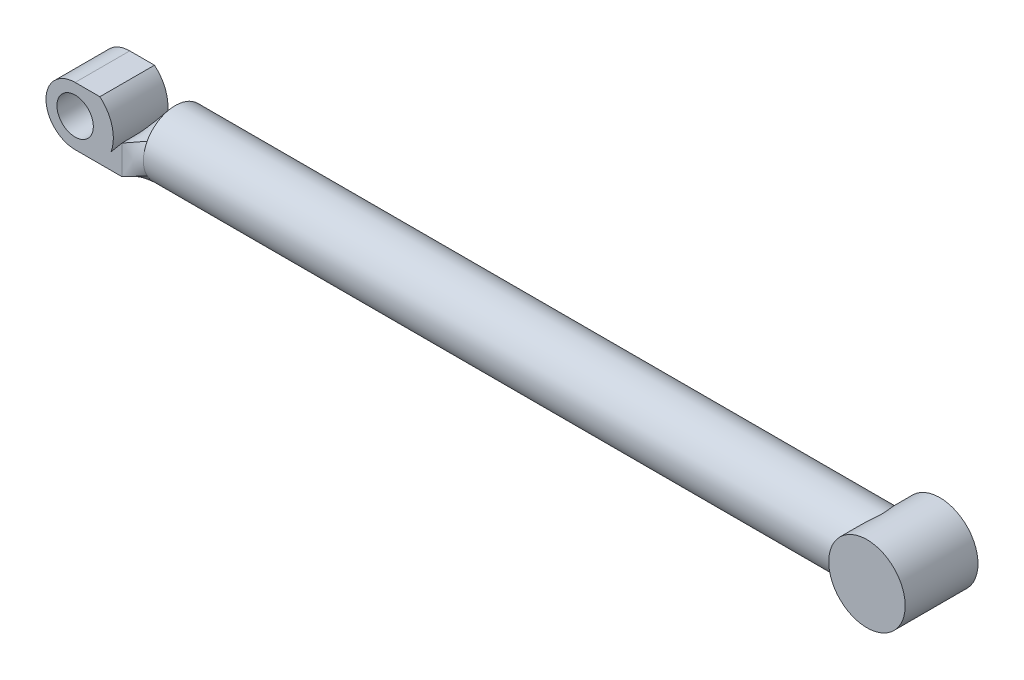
SolidWorks part; units mm, degrees
ref_plane "Front Plane" through (0, 0, 0) normal (0, 0, 1) x (1, 0, 0)
ref_plane "Top Plane" through (0, 0, 0) normal (0, 1, 0) x (1, 0, 0)
ref_plane "Right Plane" through (0, 0, 0) normal (1, 0, 0) x (0, 0, -1)
sketch "Sketch1" plane through (0, 0, 0) normal (0, 0, 1) x (1, 0, 0)
  line L0 (0, 160) -> (136.0147, 160)
  line L1 (0, -160) -> (136.0147, -160)
  circle A0 centre (0, 0) radius 100
  arc A1 (0, 160) -> (0, -160) centre (0, 0) ccw
  arc A2 (136.0147, 160) -> (136.0147, -160) centre (0, 0) cw
  dimension "D1" = 320
  dimension "D2" = 200
  dimension "D3" = 210
extrude "Boss-Extrude1" add sketch "Sketch1" along normal mid plane 300
ref_plane "Plane1" through (400, 0, 0) normal (1, 0, 0) x (0, 0, -1)
sketch "Sketch3" plane through (400, 0, 0) normal (1, 0, 0) x (0, 0, -1)
  line L4 (0, 553.9592) -> (0, -553.9592) construction
  circle A1 centre (0, 0) radius 175
  dimension "D1" = 0
  dimension "D2" = 350
extrude "Boss-Extrude2" add sketch "Sketch3" along normal blind 4000 separate body
sketch "Sketch7" plane through (0, 0, 0) normal (0, 0, 1) x (1, 0, 0)
  line L17 (257.3355, -160) -> (136.0147, -160)
  line L18 (257.3355, -71.8242) -> (257.3355, -160)
  line L19 (0, 0) -> (134.9854, -160.8693) construction
  line L20 (220, 0) -> (-220, 0) construction
  line L21 (0, 0) -> (197.3355, -71.8242) construction
  line L23 (197.3355, -71.8242) -> (257.3355, 0)
  line L24 (257.3355, 0) -> (257.3355, -71.8242)
  arc A4 (136.0147, -160) -> (136.0147, 160) centre (0, 0) ccw construction
  arc A5 (136.0147, -160) -> (197.3355, -71.8242) centre (0, 0) ccw
  dimension "D1" = 50
  dimension "D2" = 20
  dimension "D3" = 60
extrude "Boss-Extrude3" add sketch "Sketch7" along normal mid plane 300
loft "Loft4" add
sketch "Sketch8" plane through (0, 0, 0) normal (0, 0, 1) x (1, 0, 0)
  line L0 (220, 0) -> (-220, 0) construction
  line L1 (0, -220) -> (0, 220) construction
  circle A0 centre (4400, 0) radius 210
extrude "Boss-Extrude4" add sketch "Sketch8" along normal mid plane 400
sketch "Sketch9" plane through (0, 0, -200) normal (0, 0, -1) x (-1, 0, 0)
  circle A0 centre (-4400, 0) radius 175
extrude "Cut-Extrude1" cut sketch "Sketch9" against normal blind 250
equation "\"connector1_l\"= 250"
equation "\"connector1_d\"= 350"
equation "\"connector2_l\"= 220"
equation "\"connector2_d\"= 280"
equation "\"member1_d\"= 350"
equation "\"member2_d\"= 280"
equation "\"end_l\" = 400"
equation "\"end_d\" = 420"
equation "\"p1_m2_l\" = 250"
equation "\"p1_m1_l\" = 200"
equation "\"p2_m_l\" = 7500"
equation "\"p3_m_l\" = 4000"
equation "\"p3_offset\" = 400"
equation "\"D1@Plane1\"=\"p3_offset\""
equation "\"D1@Sketch8\"=\"p3_m_l\"+\"p3_offset\""
equation "\"D2@Sketch8\"=\"end_d\""
equation "\"D1@Boss-Extrude4\"=\"end_l\""
equation "\"D1@Sketch9\"=\"connector1_d\""
equation "\"D1@Cut-Extrude1\"=\"connector1_l\""
